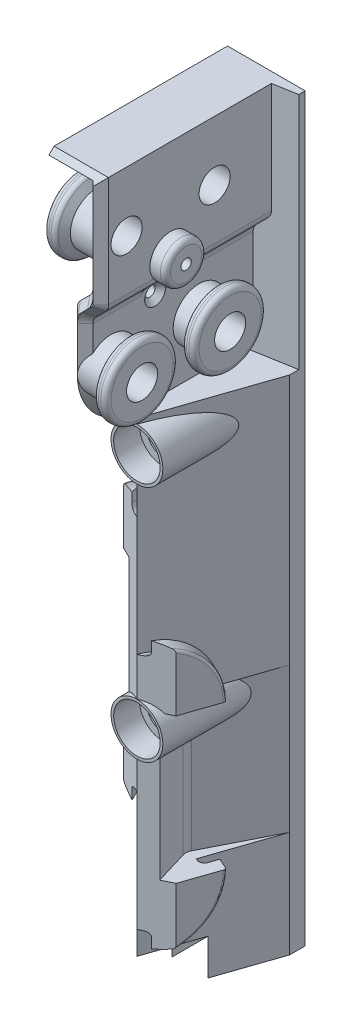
SolidWorks part; units mm, degrees
ref_plane "Plan de face" through (0, 0, 0) normal (0, 0, 1) x (1, 0, 0)
ref_plane "Plan de dessus" through (0, 0, 0) normal (0, 1, 0) x (1, 0, 0)
ref_plane "Plan de droite" through (0, 0, 0) normal (1, 0, 0) x (0, 0, -1)
body saved out of another part "Stock-hautBarette-1"
sketch "Esquisse1" plane through (0, 0, -3) normal (0, 0, -1) x (-1, 0, 0)
  line L0 (7.5, -119.9983) -> (22.5, -119.9983) construction
  line L1 (11.5, -119.9983) -> (18.5, -119.9983)
  line L2 (11.5, -119.9983) -> (11.5, -112.9983)
  line L3 (11.5, -112.9983) -> (18.5, -112.9983)
  line L4 (18.5, -119.9983) -> (18.5, -112.9983)
  line L5 (7.5, 23) -> (7.5, -119.9983) construction
  point P6 (18.5, -116.4983)
  point P7 (15, -112.9983)
  dimension "D1" = 7
  dimension "D2" = 7
  dimension "D3" = 7.5
extrude "Enlèv. mat.-Extru.1" cut sketch "Esquisse1" against normal through all
sketch "Esquisse2" plane through (0, 0, -3) normal (0, 0, -1) x (-1, 0, 0)
  line B0 (11.9628, 17.2726) -> (11.9628, -8.588) construction
sketch_block_instance "Bloc1-1"
sketch_block "Bloc1"
extrude "Enlèv. mat.-Extru.2" cut sketch "Esquisse2" against normal blind 1.5
sketch "Esquisse3" plane through (-10, 0, 0) normal (-1, 0, 0) x (0, 0, 1)
  circle A1 centre (18.5, 4) radius 1
  circle A2 centre (18.5, 4) radius 1
  dimension "D1" = 0
extrude "Enlèv. mat.-Extru.3" cut sketch "Esquisse3" against normal through all
sketch "Esquisse4" plane through (-20, 0, 0) normal (1, 0, 0) x (0, 0, -1)
  circle A1 centre (-18.5, -4) radius 1
  circle A2 centre (-18.5, -4) radius 1
  dimension "D1" = 0
extrude "Enlèv. mat.-Extru.4" cut sketch "Esquisse4" against normal through all
